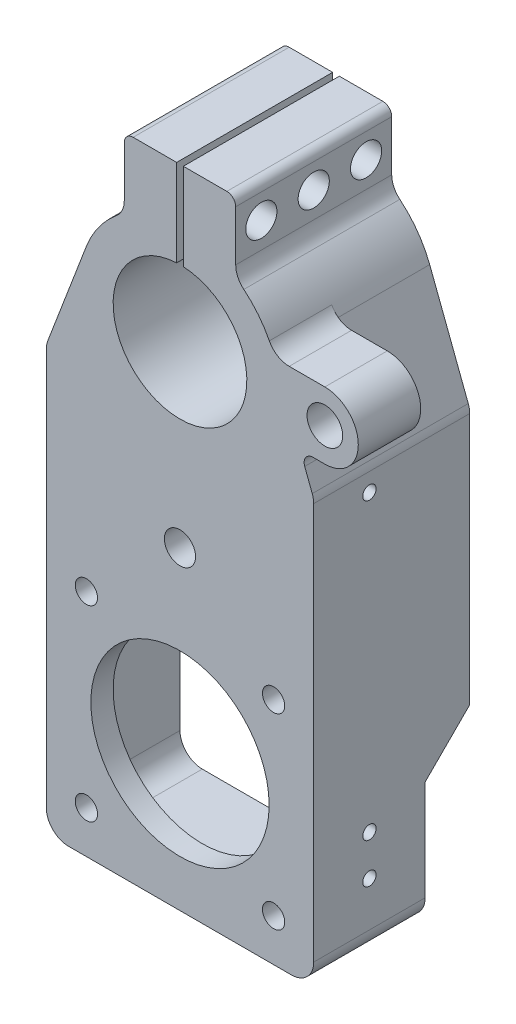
SolidWorks part; units mm, degrees
ref_plane "前视基准面" through (0, 0, 0) normal (0, 0, 1) x (1, 0, 0)
ref_plane "上视基准面" through (0, 0, 0) normal (0, 1, 0) x (1, 0, 0)
ref_plane "右视基准面" through (0, 0, 0) normal (1, 0, 0) x (0, 0, -1)
sketch "草图1" plane through (0, 0, 0) normal (0, 0, 1) x (1, 0, 0)
  line L0 (0, 0) -> (-42, 0) construction
  line L1 (-42, 0) -> (-42, -42) construction
  line L2 (0, 0) -> (0, 80) construction
  line L3 (0, 80) -> (0, 160) construction
  line L4 (0, 0) -> (60, 0) construction
  line L5 (60, 127.1563) -> (60, -51)
  line L6 (50, -61) -> (-50, -61)
  line L7 (-60, -51) -> (-60, 127.1563)
  line L8 (0, 160) -> (65, 160) construction
  line L9 (0, 160) -> (0, 229) construction
  line L10 (0, 229) -> (21.0167, 229)
  line L11 (0, 229) -> (-21.0167, 229)
  line L12 (-25, 225.0167) -> (-25, 202.4264)
  line L13 (25, 225.0167) -> (25, 202.4264)
  line L14 (-59.3425, 130.7225) -> (-42.0413, 176.0477)
  line L15 (59.3425, 130.7225) -> (55.9553, 139.5962)
  line L16 (65, 145) -> (59.6767, 145)
  line L17 (65, 175) -> (48.9898, 175)
  line L18 (42.4412, 175) -> (42.0413, 176.0477)
  circle A0 centre (0, 0) radius 40
  circle A1 centre (-42, -42) radius 5
  circle A2 centre (-42, 42) radius 5
  circle A3 centre (0, 80) radius 7
  circle A4 centre (0, 160) radius 30
  circle A5 centre (42, -42) radius 5
  circle A6 centre (42, 42) radius 5
  arc A7 (-28.6364, 194.7125) -> (-42.0413, 176.0477) centre (0, 160) ccw
  arc A8 (65, 145) -> (65, 175) centre (65, 160) ccw
  circle A9 centre (65, 160) radius 8
  arc A10 (40.0826, 180.4545) -> (28.6364, 194.7125) centre (0, 160) ccw
  arc A11 (25, 202.4264) -> (28.6364, 194.7125) centre (35, 202.4264) ccw
  arc A12 (-25, 202.4264) -> (-28.6364, 194.7125) centre (-35, 202.4264) cw
  arc A13 (-59.3425, 130.7225) -> (-60, 127.1563) centre (-50, 127.1563) ccw
  arc A14 (59.3425, 130.7225) -> (60, 127.1563) centre (50, 127.1563) cw
  arc A15 (60, -51) -> (50, -61) centre (50, -51) cw
  arc A16 (-60, -51) -> (-50, -61) centre (-50, -51) ccw
  arc A17 (40.0826, 180.4545) -> (48.9898, 175) centre (48.9898, 185) ccw
  arc A18 (-21.0167, 229) -> (-25, 225.0167) centre (-21.0167, 225.0167) ccw
  arc A19 (21.0167, 229) -> (25, 225.0167) centre (21.0167, 225.0167) cw
  arc A20 (59.6767, 145) -> (55.9553, 139.5962) centre (59.6767, 141.0167) ccw
  point P38 (-60, 129)
  dimension "D1" = 10
  dimension "D2" = 10
  dimension "D3" = 3.9833
extrude "凸台-拉伸1" add sketch "草图1" along normal blind 28
sketch "草图2" plane through (0, 0, 0) normal (0, 0, -1) x (-1, 0, 0)
  line L0 (-50, -61) -> (50, -61) construction
  line L1 (60, -51) -> (60, 127.1563) construction
  line L2 (59.3425, 130.7225) -> (42.0413, 176.0477) construction
  line L3 (25, 225.0167) -> (25, 202.4264) construction
  line L4 (21.0167, 229) -> (-21.0167, 229) construction
  line L5 (-25, 225.0167) -> (-25, 202.4264) construction
  line L6 (-50, -61) -> (50, -61)
  line L7 (60, -51) -> (60, 127.1563)
  line L8 (59.3425, 130.7225) -> (42.0413, 176.0477)
  line L9 (25, 225.0167) -> (25, 202.4264)
  line L10 (21.0167, 229) -> (-21.0167, 229)
  line L11 (-25, 225.0167) -> (-25, 202.4264)
  line L12 (0, 0) -> (0, 160) construction
  line L13 (-59.3425, 130.7225) -> (-42.0413, 176.0477)
  line L14 (-60, -51) -> (-60, 127.1563)
  circle A0 centre (0, 0) radius 40 construction
  circle A1 centre (-42, 42) radius 5 construction
  circle A2 centre (0, 80) radius 7 construction
  circle A3 centre (42, 42) radius 5 construction
  circle A4 centre (42, -42) radius 5 construction
  circle A5 centre (-42, -42) radius 5 construction
  arc A6 (-60, -51) -> (-50, -61) centre (-50, -51) ccw construction
  arc A7 (50, -61) -> (60, -51) centre (50, -51) ccw construction
  arc A8 (60, 127.1563) -> (59.3425, 130.7225) centre (50, 127.1563) ccw construction
  arc A9 (42.0413, 176.0477) -> (28.6364, 194.7125) centre (0, 160) ccw construction
  arc A10 (25, 202.4264) -> (28.6364, 194.7125) centre (35, 202.4264) ccw construction
  arc A11 (25, 225.0167) -> (21.0167, 229) centre (21.0167, 225.0167) ccw construction
  arc A12 (-21.0167, 229) -> (-25, 225.0167) centre (-21.0167, 225.0167) ccw construction
  arc A13 (-28.6364, 194.7125) -> (-25, 202.4264) centre (-35, 202.4264) ccw construction
  circle A14 centre (0, 160) radius 30 construction
  circle A15 centre (0, 0) radius 40
  circle A16 centre (-42, 42) radius 5
  circle A17 centre (0, 80) radius 7
  circle A18 centre (42, 42) radius 5
  circle A19 centre (42, -42) radius 5
  circle A20 centre (-42, -42) radius 5
  arc A21 (-60, -51) -> (-50, -61) centre (-50, -51) ccw
  arc A22 (50, -61) -> (60, -51) centre (50, -51) ccw
  arc A23 (60, 127.1563) -> (59.3425, 130.7225) centre (50, 127.1563) ccw
  arc A24 (42.0413, 176.0477) -> (28.6364, 194.7125) centre (0, 160) ccw
  arc A25 (25, 202.4264) -> (28.6364, 194.7125) centre (35, 202.4264) ccw
  arc A26 (25, 225.0167) -> (21.0167, 229) centre (21.0167, 225.0167) ccw
  arc A27 (-21.0167, 229) -> (-25, 225.0167) centre (-21.0167, 225.0167) ccw
  arc A28 (-28.6364, 194.7125) -> (-25, 202.4264) centre (-35, 202.4264) ccw
  circle A29 centre (0, 160) radius 30
  arc A30 (-42.0413, 176.0477) -> (-28.6364, 194.7125) centre (0, 160) cw
  arc A31 (-60, 127.1563) -> (-59.3425, 130.7225) centre (-50, 127.1563) cw
extrude "凸台-拉伸2" add sketch "草图2" along normal blind 42
sketch "草图3" plane through (0, 0, -42) normal (0, 0, -1) x (-1, 0, 0)
  line L0 (0, 0) -> (50, 0) construction
  line L1 (50, 128.0733) -> (50, -41)
  line L2 (40, -51) -> (-40, -51)
  line L3 (-50, -41) -> (-50, 128.0733)
  line L6 (-49.6679, 129.8651) -> (-47.3864, 135.8086)
  line L7 (0, 0) -> (0, 160) construction
  line L8 (49.6679, 129.8651) -> (47.3864, 135.8086)
  arc A0 (-38.4467, 136.6151) -> (38.4467, 136.6151) centre (0, 160) ccw
  arc A1 (49.6679, 129.8651) -> (50, 128.0733) centre (45, 128.0733) cw
  arc A2 (-49.6679, 129.8651) -> (-50, 128.0733) centre (-45, 128.0733) ccw
  arc A3 (-47.3864, 135.8086) -> (-38.4467, 136.6151) centre (-42.7185, 134.0168) cw
  arc A4 (47.3864, 135.8086) -> (38.4467, 136.6151) centre (42.7185, 134.0168) ccw
  arc A5 (50, -41) -> (40, -51) centre (40, -41) cw
  arc A6 (-50, -41) -> (-40, -51) centre (-40, -41) ccw
  dimension "D1" = 5
  dimension "D2" = 10
extrude "切除-拉伸1" cut sketch "草图3" against normal blind 60
sketch "草图4" plane through (0, 229, 0) normal (0, 1, 0) x (1, 0, 0)
  line L1 (1.5, 48.6187) -> (-1.5, 48.6187)
  line L2 (1.5, 48.6187) -> (1.5, -48.6187)
  line L3 (1.5, -48.6187) -> (-1.5, -48.6187)
  line L4 (-1.5, 48.6187) -> (-1.5, -48.6187)
  line L5 (1.5, 48.6187) -> (-1.5, -48.6187) construction
  line L6 (1.5, -48.6187) -> (-1.5, 48.6187) construction
  point P0 (0, 0)
  dimension "D1" = 3
extrude "切除-拉伸2" cut sketch "草图4" against normal blind 60
sketch "草图5" plane through (25, 0, 0) normal (1, 0, 0) x (0, 0, -1)
  line L0 (-28, 229) -> (42, 229) construction
  line L1 (42, 225.0167) -> (42, 202.4264) construction
  circle A0 centre (7, 214) radius 7
  circle A1 centre (30.5, 214) radius 7
  circle A2 centre (-16.5, 214) radius 7
  dimension "D1" = 15
  dimension "D2" = 15
  dimension "D3" = 15
  dimension "D4" = 11.5
  dimension "D5" = 47
  dimension "D6" = 35
extrude "切除-拉伸3" cut sketch "草图5" against normal blind 10
sketch "草图6" plane through (15, 0, 0) normal (1, 0, 0) x (0, 0, -1)
  circle A0 centre (-16.5, 214) radius 4.5
  circle A1 centre (7, 214) radius 4.5
  circle A2 centre (30.5, 214) radius 4.5
extrude "切除-拉伸4" cut sketch "草图6" against normal up to surface (40 mm away)
sketch "草图7" plane through (60, 0, 0) normal (1, 0, 0) x (0, 0, -1)
  line L0 (-28, -61) -> (42, -61) construction
  line L1 (22, -61) -> (42, -61)
  line L2 (42, -61) -> (42, 14) construction
  line L3 (42, -6) -> (22, -6) construction
  line L4 (22, -6) -> (42, 14)
  line L5 (22, -6) -> (22, -61)
  line L6 (42, 127.1563) -> (42, -51) construction
  line L7 (42, 14) -> (42, -61)
extrude "切除-拉伸5" cut sketch "草图7" against normal blind 120
sketch "草图8" plane through (60, 0, 0) normal (1, 0, 0) x (0, 0, -1)
  line L0 (-28, -61) -> (22, -61) construction
  line L1 (-28, 127.1563) -> (-28, -51) construction
  circle A0 centre (-3, -31) radius 3
  circle A1 centre (-3, -13) radius 3
  circle A2 centre (-3, 119) radius 3
  dimension "D1" = 30
  dimension "D2" = 18
  dimension "D3" = 132
  dimension "D4" = 25
extrude "切除-拉伸6" cut sketch "草图8" against normal blind 10
sketch "草图9" plane through (-95.3482, 36.3956, 0) normal (-0.9343, 0.3566, 0) x (0, 0, 1)
  line L0 (28, 100.9652) -> (28, 149.4802) construction
  line L1 (28, 149.4802) -> (-42, 149.4802) construction
  circle A0 centre (-2, 136.4802) radius 2.5
  circle A1 centre (-2, 114.4802) radius 2.5
  dimension "D1" = 22
  dimension "D2" = 30
  dimension "D3" = 13
extrude "切除-拉伸7" cut sketch "草图9" against normal blind 10
